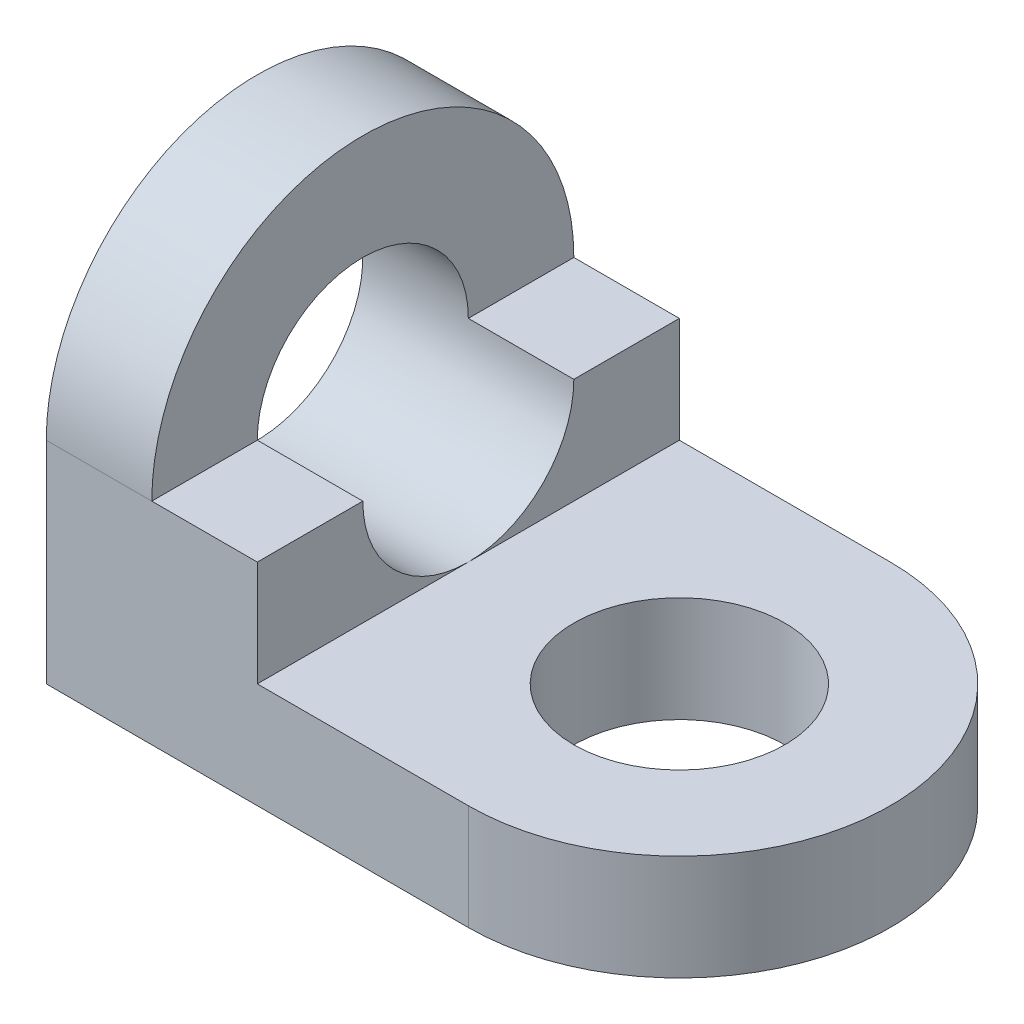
SolidWorks part; units mm, degrees
ref_plane "Front Plane" through (0, 0, 0) normal (0, 0, 1) x (1, 0, 0)
ref_plane "Top Plane" through (0, 0, 0) normal (0, 1, 0) x (1, 0, 0)
ref_plane "Right Plane" through (0, 0, 0) normal (1, 0, 0) x (0, 0, -1)
sketch "Sketch1" plane through (0, 0, 0) normal (0, 1, 0) x (1, 0, 0)
  line L0 (0, 0) -> (0, 20)
  line L1 (0, 20) -> (40, 20)
  line L2 (40, -20) -> (0, -20)
  line L3 (0, -20) -> (0, 0)
  line L4 (0, 0) -> (115.9571, 0) construction
  arc A0 (40, 20) -> (40, -20) centre (40, 0) cw
  dimension "D1" = 40
  dimension "D2" = 40
extrude "Extrude1" add sketch "Sketch1" along normal blind 10
sketch "Sketch2" plane through (0, 0, 0) normal (-1, 0, 0) x (0, 0, 1)
  line L0 (-20, 10) -> (-20, 20)
  line L1 (20, 20) -> (20, 10)
  line L2 (-20, 0) -> (20, 0) construction
  line L3 (-20, 10) -> (20, 10)
  arc A0 (-20, 20) -> (20, 20) centre (0, 20) cw
  dimension "D1" = 40
extrude "Extrude2" add sketch "Sketch2" against normal blind 10
sketch "Sketch3" plane through (10, 0, 0) normal (1, 0, 0) x (0, 0, -1)
  line L1 (-20, 10) -> (20, 10)
  line L2 (-20, 10) -> (-20, 20)
  line L3 (-20, 20) -> (20, 20)
  line L4 (20, 10) -> (20, 20)
extrude "Extrude3" add sketch "Sketch3" along normal blind 10
sketch "Sketch7" plane through (0, 0, 0) normal (-1, 0, 0) x (0, 0, 1)
  circle A0 centre (0, 20) radius 10
  dimension "D1" = 20
extrude "Extrude4" cut sketch "Sketch7" against normal through all
sketch "Sketch8" plane through (0, 10, 0) normal (0, 1, 0) x (1, 0, 0)
  circle A0 centre (40, 0) radius 10
  arc A1 (40, -20) -> (40, 20) centre (40, 0) ccw construction
  dimension "D1" = 20
extrude "Extrude5" cut sketch "Sketch8" against normal blind 10
